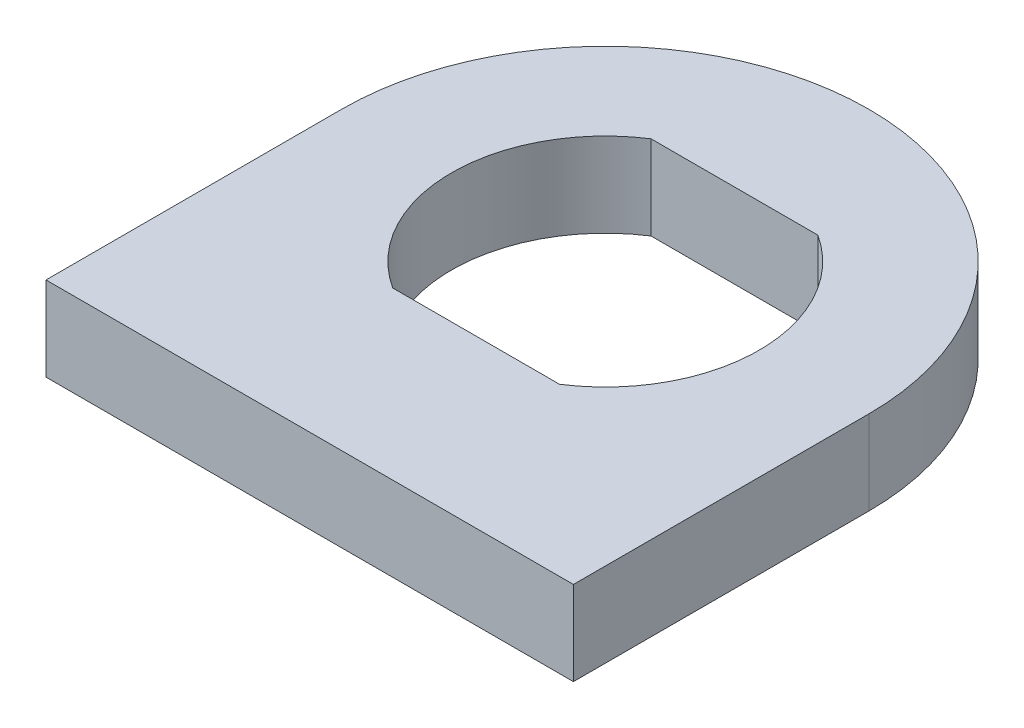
SolidWorks part; units mm, degrees
ref_plane "Front Plane" through (0, 0, 0) normal (0, 0, 1) x (1, 0, 0)
ref_plane "Top Plane" through (0, 0, 0) normal (0, 1, 0) x (1, 0, 0)
ref_plane "Right Plane" through (0, 0, 0) normal (1, 0, 0) x (0, 0, -1)
inserted part "Part5^Assem1<1>@Assem1"
sketch "Sketch2" plane through (0, 4.6734, 0) normal (0, 1, 0) x (1, 0, 0)
  line L7 (-52.5733, -21.9882) -> (-46.2832, -21.9882)
  line L8 (-46.2832, -12.246) -> (-52.5733, -12.246)
  line L9 (-52.5733, -21.9882) -> (-46.2832, -21.9882)
  line L10 (-46.2832, -12.246) -> (-52.5733, -12.246)
  arc A5 (-46.2832, -21.9882) -> (-46.2832, -12.246) centre (-49.4282, -17.1171) ccw
  arc A6 (-52.5733, -12.246) -> (-52.5733, -21.9882) centre (-49.4282, -17.1171) ccw
  arc A7 (-46.2832, -21.9882) -> (-46.2832, -12.246) centre (-49.4282, -17.1171) ccw
  arc A8 (-52.5733, -12.246) -> (-52.5733, -21.9882) centre (-49.4282, -17.1171) ccw
  dimension "D1" = 0.007
extrude "Extrude2" cut sketch "Sketch2" against normal through all
